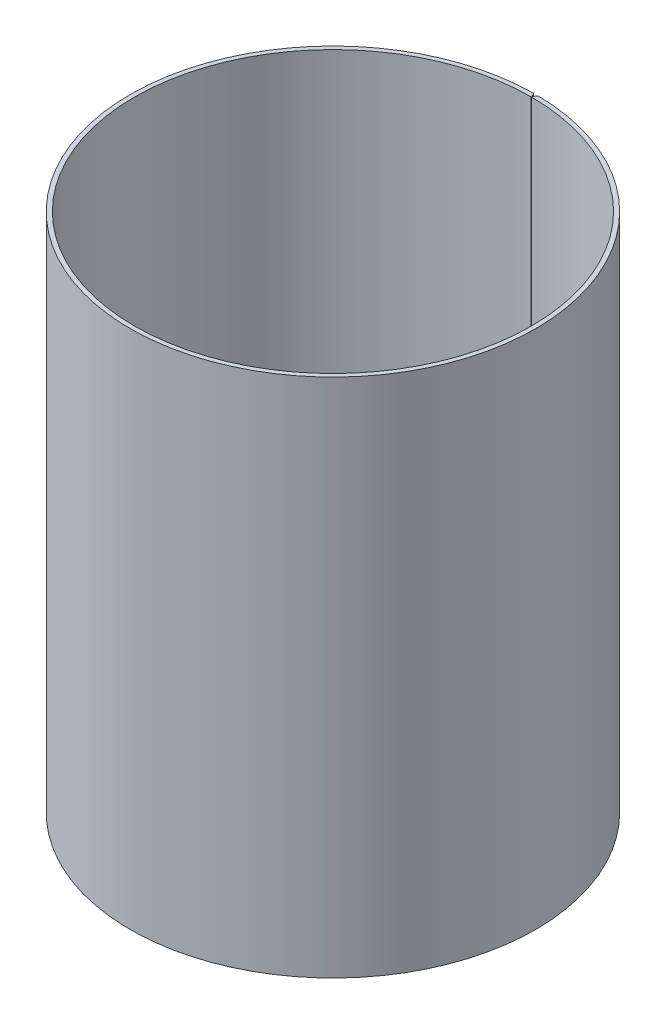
SolidWorks part; units mm, degrees
ref_plane "Front Plane" through (0, 0, 0) normal (0, 0, 1) x (1, 0, 0)
ref_plane "Top Plane" through (0, 0, 0) normal (0, 1, 0) x (1, 0, 0)
ref_plane "Right Plane" through (0, 0, 0) normal (1, 0, 0) x (0, 0, -1)
sketch "Sketch1" plane through (0, 0, 0) normal (0, 1, 0) x (1, 0, 0)
  circle A0 centre (0, 0) radius 296.8625
  circle A1 centre (0, 0) radius 290.5125
  dimension "D1" = 593.725
  dimension "D2" = 6.35
extrude "Extrude1" add sketch "Sketch1" against normal blind 762
sketch "Sketch2" plane through (0, 0, 0) normal (0, 1, 0) x (-1, 0, 0)
  line L0 (0, 0) -> (0, -307.3721) construction
  line L1 (0, -291.2872) -> (-4.7625, -299.5361)
  line L2 (0, -291.2872) -> (4.7625, -299.5361)
  dimension "D1" = 9.525
  dimension "D2" = 9.525
  dimension "D3" = 291.2872
  dimension "D4" = 30
  dimension "D5" = 30
extrude "Cut-Extrude1" cut sketch "Sketch2" against normal through all and the other way through all flip side to cut
sketch "Sketch3" plane through (0, 0, 0) normal (0, 1, 0) x (-1, 0, 0)
  line L1 (0.1905, -288.925) -> (-0.1905, -288.925)
  line L2 (0.1905, -288.925) -> (0.1905, -295.275)
  line L3 (0.1905, -295.275) -> (-0.1905, -295.275)
  line L4 (-0.1905, -288.925) -> (-0.1905, -295.275)
  dimension "D1" = 0.381
  dimension "D2" = 0.1905
  dimension "D3" = 6.35
  dimension "D4" = 288.925
extrude "Cut-Extrude2" cut sketch "Sketch3" against normal through all
